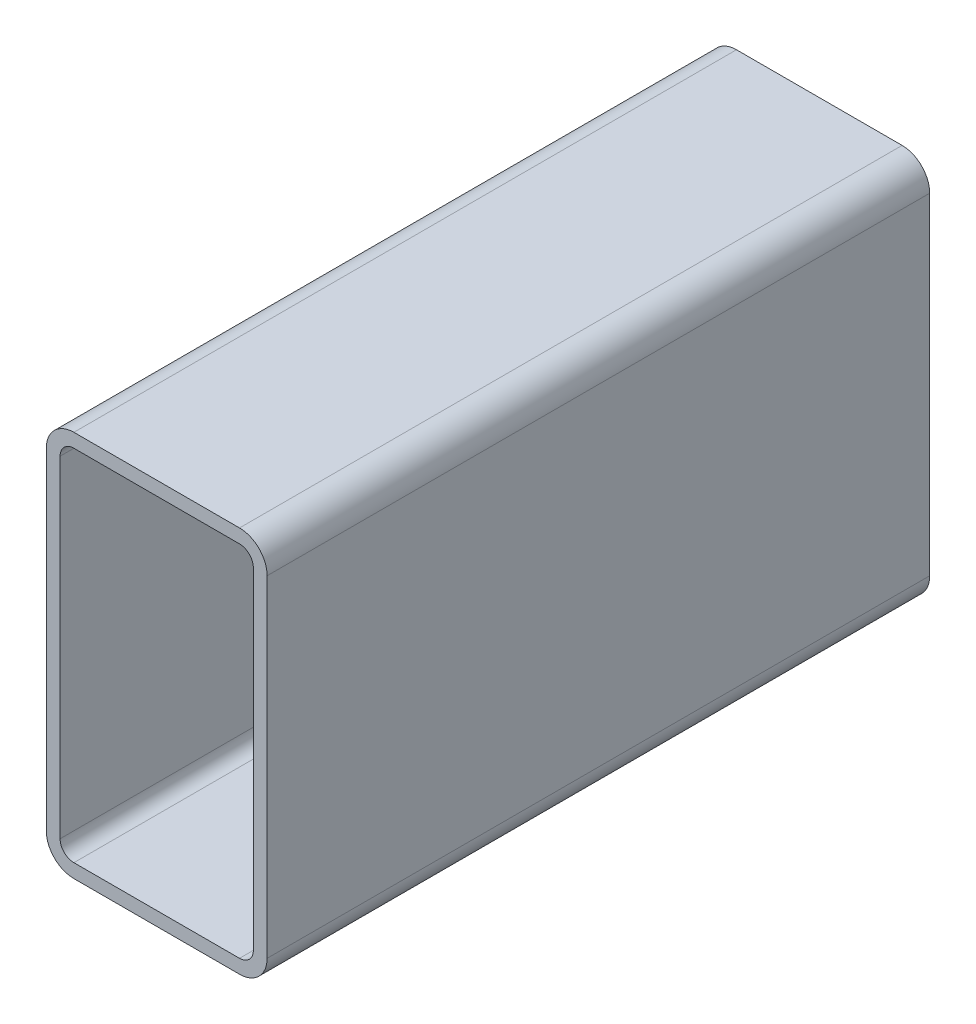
SolidWorks part; units mm, degrees
ref_plane "Front Plane" through (0, 0, 0) normal (0, 0, 1) x (1, 0, 0)
ref_plane "Top Plane" through (0, 0, 0) normal (0, 1, 0) x (1, 0, 0)
ref_plane "Right Plane" through (0, 0, 0) normal (1, 0, 0) x (0, 0, -1)
sketch "Sketch1" plane through (0, 0, 0) normal (0, 0, 1) x (1, 0, 0)
sketch_block_instance "HSS7x4x0.250-1"
sketch_block "HSS7x4x0.250"
extrude "Boss-Extrude1" add sketch "Sketch1" along normal blind 304.8
